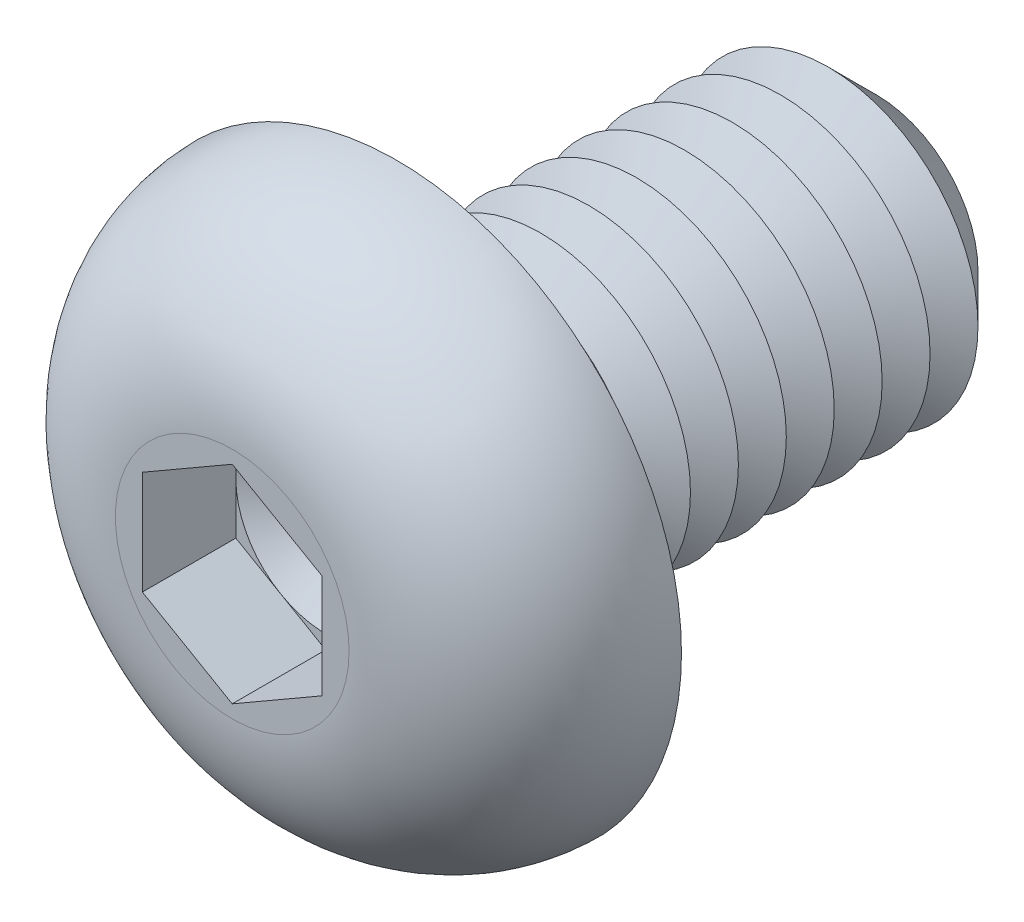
SolidWorks part; units mm, degrees
ref_plane "Front Plane" through (0, 0, 0) normal (0, 0, 1) x (1, 0, 0)
ref_plane "Top Plane" through (0, 0, 0) normal (0, 1, 0) x (1, 0, 0)
ref_plane "Right Plane" through (0, 0, 0) normal (1, 0, 0) x (0, 0, -1)
sketch "Sketch1" plane through (0, 0, 0) normal (1, 0, 0) x (0, 0, -1)
  line L0 (-47.9342, 0) -> (60.3146, 0) construction
sketch "Sketch2" plane through (0, 0, 0) normal (1, 0, 0) x (0, 0, -1)
  line L0 (0, 0) -> (-2.75, 0)
  line L1 (-47.9342, 0) -> (60.3146, 0) construction
  line L2 (-2.75, 0) -> (-2.75, 1.9504)
  line L3 (0, 4.75) -> (0, 0)
  arc A0 (-2.75, 1.9504) -> (0, 4.75) centre (0.05, 1.9504) cw
  dimension "D1" = 2.8
  dimension "D2" = 2.75
  dimension "D3" = 4.75
revolve "Revolve1" add sketch "Sketch2" angle 360 about L0
sketch "Sketch3" plane through (0, 0, 2.75) normal (0, 0, 1) x (1, 0, 0)
  line L1 (0, 1.7321) -> (-1.5, 0.866)
  line L2 (-1.5, 0.866) -> (-1.5, -0.866)
  line L3 (-1.5, -0.866) -> (0, -1.7321)
  line L4 (0, -1.7321) -> (1.5, -0.866)
  line L5 (1.5, -0.866) -> (1.5, 0.866)
  line L6 (1.5, 0.866) -> (0, 1.7321)
  circle A0 centre (0, 0) radius 1.5 construction
  dimension "D1" = 3
extrude "Cut-Extrude1" cut sketch "Sketch3" against normal blind 1.56
sketch "Sketch4" plane through (0, 0, 0) normal (0, 0, -1) x (-1, 0, 0)
  circle A0 centre (0, 0) radius 2.5
  dimension "D1" = 5
extrude "Boss-Extrude1" add sketch "Sketch4" along normal blind 8
chamfer "Chamfer1" distance 0.8 angle 45 1 edges at (-2.5, 0, -8)
sketch "Sketch5" plane through (0, 0, 0) normal (1, 0, 0) x (0, 0, -1)
  line L0 (0.8, 2.5) -> (1.6, 2.5)
  line L1 (7.2, 2.5) -> (0, 2.5) construction
  line L2 (1.6, 2.5) -> (1.2, 1.8072)
  line L3 (1.2, 1.8072) -> (0.8, 2.5)
  line L4 (0, -4.75) -> (0, 4.75) construction
  line L5 (7.2, 2.5) -> (0, 2.5) construction
  dimension "D1" = 0.8
  dimension "D2" = 0.8
revolve "Cut-Revolve1" cut sketch "Sketch5" angle 360 about L0
pattern_linear "LPattern1" count 8 spacing 0.8 along (0, 0, -1) of "Cut-Revolve1"
fillet "Fillet2" radius 0.4 1 edges at (2.5, 0, 0)
sketch "Sketch6" plane through (0, 0, 1.19) normal (0, 0, 1) x (1, 0, 0)
  line L0 (0, -1.7321) -> (1.5, -0.866) construction
  circle A0 centre (0, 0) radius 1.5
extrude "Cut-Extrude2" cut sketch "Sketch6" against normal through all draft 60
